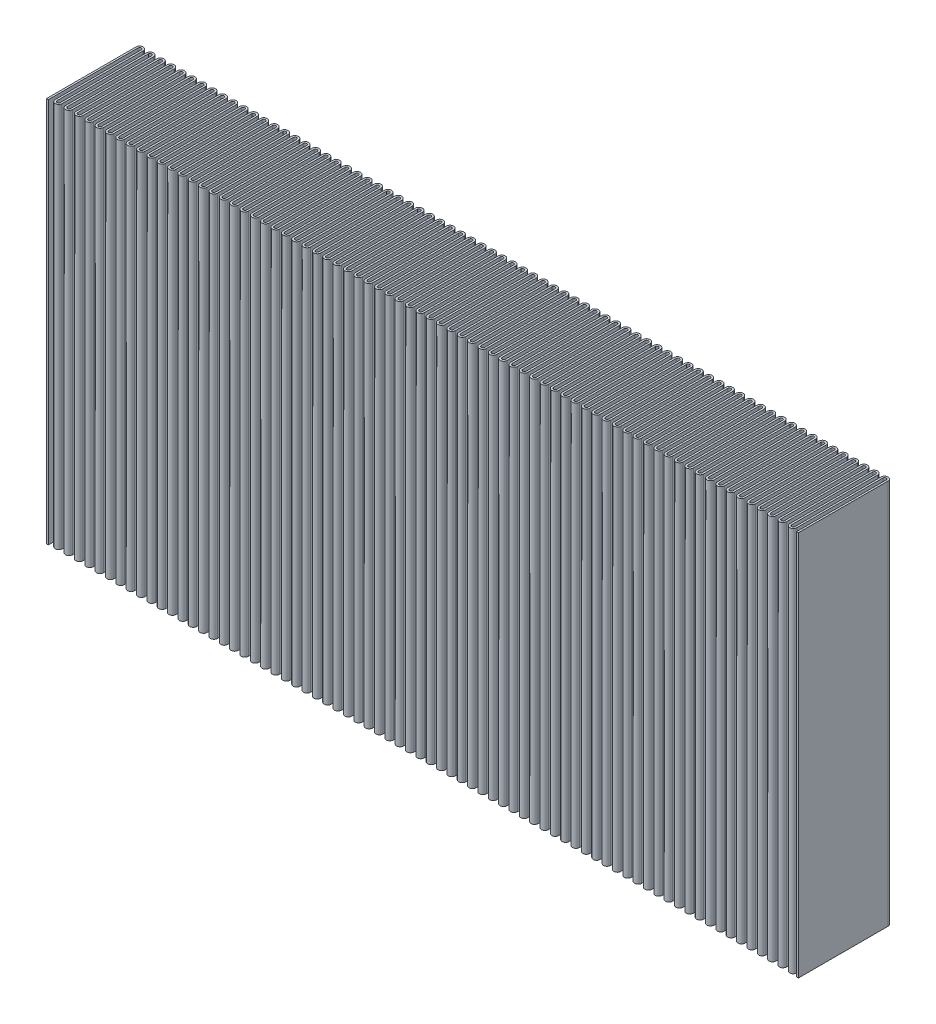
SolidWorks part; units mm, degrees
ref_plane "Front Plane" through (0, 0, 0) normal (0, 0, 1) x (1, 0, 0)
ref_plane "Top Plane" through (0, 0, 0) normal (0, 1, 0) x (1, 0, 0)
ref_plane "Right Plane" through (0, 0, 0) normal (1, 0, 0) x (0, 0, -1)
sketch "Sketch1" plane through (0, 0, 0) normal (0, 1, 0) x (1, 0, 0)
  line L8 (0, 0) -> (0, 9.9) construction
  line L9 (0, 9.9) -> (0.55, 9.9) construction
  line L10 (0.55, 9.9) -> (0.55, 0) construction
  line L11 (0.55, 0) -> (0, 0) construction
  line L12 (0.275, 9.9) -> (0.275, 9.78) construction
  line L13 (0.175, 9.525) -> (0.175, 0.375)
  line L14 (0.375, 9.525) -> (0.375, 0.375)
  line L18 (0, 9.9) -> (0, 9.7)
  line L19 (0.55, 0) -> (0.55, 0.2)
  line L20 (-0.175, 9.525) -> (-0.175, 0.375)
  line L21 (-0.375, 9.525) -> (-0.375, 0.375)
  line L22 (-0.175, 0.375) -> (-0.175, 0)
  line L23 (-0.175, 0) -> (-0.375, 0)
  line L24 (-0.375, 0) -> (-0.375, 0.375)
  line L25 (-0.375, 0) -> (79.575, 0) construction
  line L26 (0.925, 9.525) -> (0.925, 0.375)
  line L27 (0.725, 9.525) -> (0.725, 0.375)
  line L28 (1.1, 9.9) -> (1.1, 9.7) construction
  line L29 (1.275, 9.525) -> (1.275, 0.375)
  line L30 (1.475, 9.525) -> (1.475, 0.375)
  line L31 (2.025, 9.525) -> (2.025, 0.375)
  line L32 (1.825, 9.525) -> (1.825, 0.375)
  line L33 (2.375, 9.525) -> (2.375, 0.375)
  line L34 (2.575, 9.525) -> (2.575, 0.375)
  line L35 (3.125, 9.525) -> (3.125, 0.375)
  line L36 (2.925, 9.525) -> (2.925, 0.375)
  line L37 (3.475, 9.525) -> (3.475, 0.375)
  line L38 (3.675, 9.525) -> (3.675, 0.375)
  line L39 (4.225, 9.525) -> (4.225, 0.375)
  line L40 (4.025, 9.525) -> (4.025, 0.375)
  line L41 (4.575, 9.525) -> (4.575, 0.375)
  line L42 (4.775, 9.525) -> (4.775, 0.375)
  line L43 (5.325, 9.525) -> (5.325, 0.375)
  line L44 (5.125, 9.525) -> (5.125, 0.375)
  line L45 (5.675, 9.525) -> (5.675, 0.375)
  line L46 (5.875, 9.525) -> (5.875, 0.375)
  line L47 (6.425, 9.525) -> (6.425, 0.375)
  line L48 (6.225, 9.525) -> (6.225, 0.375)
  line L49 (6.775, 9.525) -> (6.775, 0.375)
  line L50 (6.975, 9.525) -> (6.975, 0.375)
  line L51 (7.525, 9.525) -> (7.525, 0.375)
  line L52 (7.325, 9.525) -> (7.325, 0.375)
  line L53 (7.875, 9.525) -> (7.875, 0.375)
  line L54 (8.075, 9.525) -> (8.075, 0.375)
  line L55 (8.625, 9.525) -> (8.625, 0.375)
  line L56 (8.425, 9.525) -> (8.425, 0.375)
  line L57 (8.975, 9.525) -> (8.975, 0.375)
  line L58 (9.175, 9.525) -> (9.175, 0.375)
  line L59 (9.725, 9.525) -> (9.725, 0.375)
  line L60 (9.525, 9.525) -> (9.525, 0.375)
  line L61 (10.075, 9.525) -> (10.075, 0.375)
  line L62 (10.275, 9.525) -> (10.275, 0.375)
  line L63 (10.825, 9.525) -> (10.825, 0.375)
  line L64 (10.625, 9.525) -> (10.625, 0.375)
  line L65 (11.175, 9.525) -> (11.175, 0.375)
  line L66 (11.375, 9.525) -> (11.375, 0.375)
  line L67 (11.925, 9.525) -> (11.925, 0.375)
  line L68 (11.725, 9.525) -> (11.725, 0.375)
  line L69 (12.275, 9.525) -> (12.275, 0.375)
  line L70 (12.475, 9.525) -> (12.475, 0.375)
  line L71 (13.025, 9.525) -> (13.025, 0.375)
  line L72 (12.825, 9.525) -> (12.825, 0.375)
  line L73 (13.375, 9.525) -> (13.375, 0.375)
  line L74 (13.575, 9.525) -> (13.575, 0.375)
  line L75 (14.125, 9.525) -> (14.125, 0.375)
  line L76 (13.925, 9.525) -> (13.925, 0.375)
  line L77 (14.475, 9.525) -> (14.475, 0.375)
  line L78 (14.675, 9.525) -> (14.675, 0.375)
  line L79 (15.225, 9.525) -> (15.225, 0.375)
  line L80 (15.025, 9.525) -> (15.025, 0.375)
  line L81 (15.575, 9.525) -> (15.575, 0.375)
  line L82 (15.775, 9.525) -> (15.775, 0.375)
  line L83 (16.325, 9.525) -> (16.325, 0.375)
  line L84 (16.125, 9.525) -> (16.125, 0.375)
  line L85 (16.675, 9.525) -> (16.675, 0.375)
  line L86 (16.875, 9.525) -> (16.875, 0.375)
  line L87 (17.425, 9.525) -> (17.425, 0.375)
  line L88 (17.225, 9.525) -> (17.225, 0.375)
  line L89 (17.775, 9.525) -> (17.775, 0.375)
  line L90 (17.975, 9.525) -> (17.975, 0.375)
  line L91 (18.525, 9.525) -> (18.525, 0.375)
  line L92 (18.325, 9.525) -> (18.325, 0.375)
  line L93 (18.875, 9.525) -> (18.875, 0.375)
  line L94 (19.075, 9.525) -> (19.075, 0.375)
  line L95 (19.625, 9.525) -> (19.625, 0.375)
  line L96 (19.425, 9.525) -> (19.425, 0.375)
  line L97 (19.975, 9.525) -> (19.975, 0.375)
  line L98 (20.175, 9.525) -> (20.175, 0.375)
  line L99 (20.725, 9.525) -> (20.725, 0.375)
  line L100 (20.525, 9.525) -> (20.525, 0.375)
  line L101 (21.075, 9.525) -> (21.075, 0.375)
  line L102 (21.275, 9.525) -> (21.275, 0.375)
  line L103 (21.825, 9.525) -> (21.825, 0.375)
  line L104 (21.625, 9.525) -> (21.625, 0.375)
  line L105 (22.175, 9.525) -> (22.175, 0.375)
  line L106 (22.375, 9.525) -> (22.375, 0.375)
  line L107 (22.925, 9.525) -> (22.925, 0.375)
  line L108 (22.725, 9.525) -> (22.725, 0.375)
  line L109 (23.275, 9.525) -> (23.275, 0.375)
  line L110 (23.475, 9.525) -> (23.475, 0.375)
  line L111 (24.025, 9.525) -> (24.025, 0.375)
  line L112 (23.825, 9.525) -> (23.825, 0.375)
  line L113 (24.375, 9.525) -> (24.375, 0.375)
  line L114 (24.575, 9.525) -> (24.575, 0.375)
  line L115 (25.125, 9.525) -> (25.125, 0.375)
  line L116 (24.925, 9.525) -> (24.925, 0.375)
  line L117 (25.475, 9.525) -> (25.475, 0.375)
  line L118 (25.675, 9.525) -> (25.675, 0.375)
  line L119 (26.225, 9.525) -> (26.225, 0.375)
  line L120 (26.025, 9.525) -> (26.025, 0.375)
  line L121 (26.575, 9.525) -> (26.575, 0.375)
  line L122 (26.775, 9.525) -> (26.775, 0.375)
  line L123 (27.325, 9.525) -> (27.325, 0.375)
  line L124 (27.125, 9.525) -> (27.125, 0.375)
  line L125 (27.675, 9.525) -> (27.675, 0.375)
  line L126 (27.875, 9.525) -> (27.875, 0.375)
  line L127 (28.425, 9.525) -> (28.425, 0.375)
  line L128 (28.225, 9.525) -> (28.225, 0.375)
  line L129 (28.775, 9.525) -> (28.775, 0.375)
  line L130 (28.975, 9.525) -> (28.975, 0.375)
  line L131 (29.525, 9.525) -> (29.525, 0.375)
  line L132 (29.325, 9.525) -> (29.325, 0.375)
  line L133 (29.875, 9.525) -> (29.875, 0.375)
  line L134 (30.075, 9.525) -> (30.075, 0.375)
  line L135 (30.625, 9.525) -> (30.625, 0.375)
  line L136 (30.425, 9.525) -> (30.425, 0.375)
  line L137 (30.975, 9.525) -> (30.975, 0.375)
  line L138 (31.175, 9.525) -> (31.175, 0.375)
  line L139 (31.725, 9.525) -> (31.725, 0.375)
  line L140 (31.525, 9.525) -> (31.525, 0.375)
  line L141 (32.075, 9.525) -> (32.075, 0.375)
  line L142 (32.275, 9.525) -> (32.275, 0.375)
  line L143 (32.825, 9.525) -> (32.825, 0.375)
  line L144 (32.625, 9.525) -> (32.625, 0.375)
  line L145 (33.175, 9.525) -> (33.175, 0.375)
  line L146 (33.375, 9.525) -> (33.375, 0.375)
  line L147 (33.925, 9.525) -> (33.925, 0.375)
  line L148 (33.725, 9.525) -> (33.725, 0.375)
  line L149 (34.275, 9.525) -> (34.275, 0.375)
  line L150 (34.475, 9.525) -> (34.475, 0.375)
  line L151 (35.025, 9.525) -> (35.025, 0.375)
  line L152 (34.825, 9.525) -> (34.825, 0.375)
  line L153 (35.375, 9.525) -> (35.375, 0.375)
  line L154 (35.575, 9.525) -> (35.575, 0.375)
  line L155 (36.125, 9.525) -> (36.125, 0.375)
  line L156 (35.925, 9.525) -> (35.925, 0.375)
  line L157 (79.375, 9.525) -> (79.375, 0)
  line L158 (79.375, 0) -> (79.575, 0)
  line L159 (79.575, 0) -> (79.575, 9.525)
  line L160 (36.475, 9.525) -> (36.475, 0.375)
  line L161 (36.675, 9.525) -> (36.675, 0.375)
  line L162 (37.225, 9.525) -> (37.225, 0.375)
  line L163 (37.025, 9.525) -> (37.025, 0.375)
  line L164 (37.575, 9.525) -> (37.575, 0.375)
  line L165 (37.775, 9.525) -> (37.775, 0.375)
  line L166 (38.325, 9.525) -> (38.325, 0.375)
  line L167 (38.125, 9.525) -> (38.125, 0.375)
  line L168 (38.675, 9.525) -> (38.675, 0.375)
  line L169 (38.875, 9.525) -> (38.875, 0.375)
  line L170 (39.425, 9.525) -> (39.425, 0.375)
  line L171 (39.225, 9.525) -> (39.225, 0.375)
  line L172 (39.775, 9.525) -> (39.775, 0.375)
  line L173 (39.975, 9.525) -> (39.975, 0.375)
  line L174 (40.525, 9.525) -> (40.525, 0.375)
  line L175 (40.325, 9.525) -> (40.325, 0.375)
  line L176 (40.875, 9.525) -> (40.875, 0.375)
  line L177 (41.075, 9.525) -> (41.075, 0.375)
  line L178 (41.625, 9.525) -> (41.625, 0.375)
  line L179 (41.425, 9.525) -> (41.425, 0.375)
  line L180 (41.975, 9.525) -> (41.975, 0.375)
  line L181 (42.175, 9.525) -> (42.175, 0.375)
  line L182 (42.725, 9.525) -> (42.725, 0.375)
  line L183 (42.525, 9.525) -> (42.525, 0.375)
  line L184 (43.075, 9.525) -> (43.075, 0.375)
  line L185 (43.275, 9.525) -> (43.275, 0.375)
  line L186 (43.825, 9.525) -> (43.825, 0.375)
  line L187 (43.625, 9.525) -> (43.625, 0.375)
  line L188 (44.175, 9.525) -> (44.175, 0.375)
  line L189 (44.375, 9.525) -> (44.375, 0.375)
  line L190 (44.925, 9.525) -> (44.925, 0.375)
  line L191 (44.725, 9.525) -> (44.725, 0.375)
  line L192 (45.275, 9.525) -> (45.275, 0.375)
  line L193 (45.475, 9.525) -> (45.475, 0.375)
  line L194 (46.025, 9.525) -> (46.025, 0.375)
  line L195 (45.825, 9.525) -> (45.825, 0.375)
  line L196 (46.375, 9.525) -> (46.375, 0.375)
  line L197 (46.575, 9.525) -> (46.575, 0.375)
  line L198 (47.125, 9.525) -> (47.125, 0.375)
  line L199 (46.925, 9.525) -> (46.925, 0.375)
  line L200 (47.475, 9.525) -> (47.475, 0.375)
  line L201 (47.675, 9.525) -> (47.675, 0.375)
  line L202 (48.225, 9.525) -> (48.225, 0.375)
  line L203 (48.025, 9.525) -> (48.025, 0.375)
  line L204 (48.575, 9.525) -> (48.575, 0.375)
  line L205 (48.775, 9.525) -> (48.775, 0.375)
  line L206 (49.325, 9.525) -> (49.325, 0.375)
  line L207 (49.125, 9.525) -> (49.125, 0.375)
  line L208 (49.675, 9.525) -> (49.675, 0.375)
  line L209 (49.875, 9.525) -> (49.875, 0.375)
  line L210 (50.425, 9.525) -> (50.425, 0.375)
  line L211 (50.225, 9.525) -> (50.225, 0.375)
  line L212 (50.775, 9.525) -> (50.775, 0.375)
  line L213 (50.975, 9.525) -> (50.975, 0.375)
  line L214 (51.525, 9.525) -> (51.525, 0.375)
  line L215 (51.325, 9.525) -> (51.325, 0.375)
  line L216 (51.875, 9.525) -> (51.875, 0.375)
  line L217 (52.075, 9.525) -> (52.075, 0.375)
  line L218 (52.625, 9.525) -> (52.625, 0.375)
  line L219 (52.425, 9.525) -> (52.425, 0.375)
  line L220 (52.975, 9.525) -> (52.975, 0.375)
  line L221 (53.175, 9.525) -> (53.175, 0.375)
  line L222 (53.725, 9.525) -> (53.725, 0.375)
  line L223 (53.525, 9.525) -> (53.525, 0.375)
  line L224 (54.075, 9.525) -> (54.075, 0.375)
  line L225 (54.275, 9.525) -> (54.275, 0.375)
  line L226 (54.825, 9.525) -> (54.825, 0.375)
  line L227 (54.625, 9.525) -> (54.625, 0.375)
  line L228 (55.175, 9.525) -> (55.175, 0.375)
  line L229 (55.375, 9.525) -> (55.375, 0.375)
  line L230 (55.925, 9.525) -> (55.925, 0.375)
  line L231 (55.725, 9.525) -> (55.725, 0.375)
  line L232 (56.275, 9.525) -> (56.275, 0.375)
  line L233 (56.475, 9.525) -> (56.475, 0.375)
  line L234 (57.025, 9.525) -> (57.025, 0.375)
  line L235 (56.825, 9.525) -> (56.825, 0.375)
  line L236 (57.375, 9.525) -> (57.375, 0.375)
  line L237 (57.575, 9.525) -> (57.575, 0.375)
  line L238 (58.125, 9.525) -> (58.125, 0.375)
  line L239 (57.925, 9.525) -> (57.925, 0.375)
  line L240 (58.475, 9.525) -> (58.475, 0.375)
  line L241 (58.675, 9.525) -> (58.675, 0.375)
  line L242 (59.225, 9.525) -> (59.225, 0.375)
  line L243 (59.025, 9.525) -> (59.025, 0.375)
  line L244 (59.575, 9.525) -> (59.575, 0.375)
  line L245 (59.775, 9.525) -> (59.775, 0.375)
  line L246 (60.325, 9.525) -> (60.325, 0.375)
  line L247 (60.125, 9.525) -> (60.125, 0.375)
  line L248 (60.675, 9.525) -> (60.675, 0.375)
  line L249 (60.875, 9.525) -> (60.875, 0.375)
  line L250 (61.425, 9.525) -> (61.425, 0.375)
  line L251 (61.225, 9.525) -> (61.225, 0.375)
  line L252 (61.775, 9.525) -> (61.775, 0.375)
  line L253 (61.975, 9.525) -> (61.975, 0.375)
  line L254 (62.525, 9.525) -> (62.525, 0.375)
  line L255 (62.325, 9.525) -> (62.325, 0.375)
  line L256 (62.875, 9.525) -> (62.875, 0.375)
  line L257 (63.075, 9.525) -> (63.075, 0.375)
  line L258 (63.625, 9.525) -> (63.625, 0.375)
  line L259 (63.425, 9.525) -> (63.425, 0.375)
  line L260 (63.975, 9.525) -> (63.975, 0.375)
  line L261 (64.175, 9.525) -> (64.175, 0.375)
  line L262 (64.725, 9.525) -> (64.725, 0.375)
  line L263 (64.525, 9.525) -> (64.525, 0.375)
  line L264 (65.075, 9.525) -> (65.075, 0.375)
  line L265 (65.275, 9.525) -> (65.275, 0.375)
  line L266 (65.825, 9.525) -> (65.825, 0.375)
  line L267 (65.625, 9.525) -> (65.625, 0.375)
  line L268 (66.175, 9.525) -> (66.175, 0.375)
  line L269 (66.375, 9.525) -> (66.375, 0.375)
  line L270 (66.925, 9.525) -> (66.925, 0.375)
  line L271 (66.725, 9.525) -> (66.725, 0.375)
  line L272 (67.275, 9.525) -> (67.275, 0.375)
  line L273 (67.475, 9.525) -> (67.475, 0.375)
  line L274 (68.025, 9.525) -> (68.025, 0.375)
  line L275 (67.825, 9.525) -> (67.825, 0.375)
  line L276 (68.375, 9.525) -> (68.375, 0.375)
  line L277 (68.575, 9.525) -> (68.575, 0.375)
  line L278 (69.125, 9.525) -> (69.125, 0.375)
  line L279 (68.925, 9.525) -> (68.925, 0.375)
  line L280 (69.475, 9.525) -> (69.475, 0.375)
  line L281 (69.675, 9.525) -> (69.675, 0.375)
  line L282 (70.225, 9.525) -> (70.225, 0.375)
  line L283 (70.025, 9.525) -> (70.025, 0.375)
  line L284 (70.575, 9.525) -> (70.575, 0.375)
  line L285 (70.775, 9.525) -> (70.775, 0.375)
  line L286 (71.325, 9.525) -> (71.325, 0.375)
  line L287 (71.125, 9.525) -> (71.125, 0.375)
  line L288 (71.675, 9.525) -> (71.675, 0.375)
  line L289 (71.875, 9.525) -> (71.875, 0.375)
  line L290 (72.425, 9.525) -> (72.425, 0.375)
  line L291 (72.225, 9.525) -> (72.225, 0.375)
  line L292 (72.775, 9.525) -> (72.775, 0.375)
  line L293 (72.975, 9.525) -> (72.975, 0.375)
  line L294 (73.525, 9.525) -> (73.525, 0.375)
  line L295 (73.325, 9.525) -> (73.325, 0.375)
  line L296 (73.875, 9.525) -> (73.875, 0.375)
  line L297 (74.075, 9.525) -> (74.075, 0.375)
  line L298 (74.625, 9.525) -> (74.625, 0.375)
  line L299 (74.425, 9.525) -> (74.425, 0.375)
  line L300 (74.975, 9.525) -> (74.975, 0.375)
  line L301 (75.175, 9.525) -> (75.175, 0.375)
  line L302 (75.725, 9.525) -> (75.725, 0.375)
  line L303 (75.525, 9.525) -> (75.525, 0.375)
  line L304 (76.075, 9.525) -> (76.075, 0.375)
  line L305 (76.275, 9.525) -> (76.275, 0.375)
  line L306 (76.825, 9.525) -> (76.825, 0.375)
  line L307 (76.625, 9.525) -> (76.625, 0.375)
  line L308 (77.175, 9.525) -> (77.175, 0.375)
  line L309 (77.375, 9.525) -> (77.375, 0.375)
  line L310 (77.925, 9.525) -> (77.925, 0.375)
  line L311 (77.725, 9.525) -> (77.725, 0.375)
  line L312 (78.275, 9.525) -> (78.275, 0.375)
  line L313 (78.475, 9.525) -> (78.475, 0.375)
  line L314 (79.025, 9.525) -> (79.025, 0.375)
  line L315 (78.825, 9.525) -> (78.825, 0.375)
  line L316 (0.175, 9.525) -> (1.275, 9.525) construction
  arc A3 (0.375, 9.525) -> (0, 9.9) centre (0, 9.525) ccw
  arc A4 (0.175, 9.525) -> (0, 9.7) centre (0, 9.525) ccw
  arc A5 (0.175, 0.375) -> (0.925, 0.375) centre (0.55, 0.375) ccw
  arc A6 (0.375, 0.375) -> (0.725, 0.375) centre (0.55, 0.375) ccw
  arc A7 (0.925, 9.525) -> (1.1, 9.7) centre (1.1, 9.525) cw
  arc A8 (0.725, 9.525) -> (1.1, 9.9) centre (1.1, 9.525) cw
  arc A9 (0, 9.7) -> (-0.175, 9.525) centre (0, 9.525) ccw
  arc A10 (0, 9.9) -> (-0.375, 9.525) centre (0, 9.525) ccw
  arc A11 (1.275, 9.525) -> (1.1, 9.7) centre (1.1, 9.525) ccw
  arc A12 (1.475, 9.525) -> (1.1, 9.9) centre (1.1, 9.525) ccw
  arc A13 (1.475, 0.375) -> (1.825, 0.375) centre (1.65, 0.375) ccw
  arc A14 (1.275, 0.375) -> (2.025, 0.375) centre (1.65, 0.375) ccw
  arc A15 (1.825, 9.525) -> (2.2, 9.9) centre (2.2, 9.525) cw
  arc A16 (2.025, 9.525) -> (2.2, 9.7) centre (2.2, 9.525) cw
  arc A17 (2.375, 9.525) -> (2.2, 9.7) centre (2.2, 9.525) ccw
  arc A18 (2.575, 9.525) -> (2.2, 9.9) centre (2.2, 9.525) ccw
  arc A19 (2.575, 0.375) -> (2.925, 0.375) centre (2.75, 0.375) ccw
  arc A20 (2.375, 0.375) -> (3.125, 0.375) centre (2.75, 0.375) ccw
  arc A21 (2.925, 9.525) -> (3.3, 9.9) centre (3.3, 9.525) cw
  arc A22 (3.125, 9.525) -> (3.3, 9.7) centre (3.3, 9.525) cw
  arc A23 (3.475, 9.525) -> (3.3, 9.7) centre (3.3, 9.525) ccw
  arc A24 (3.675, 9.525) -> (3.3, 9.9) centre (3.3, 9.525) ccw
  arc A25 (3.675, 0.375) -> (4.025, 0.375) centre (3.85, 0.375) ccw
  arc A26 (3.475, 0.375) -> (4.225, 0.375) centre (3.85, 0.375) ccw
  arc A27 (4.025, 9.525) -> (4.4, 9.9) centre (4.4, 9.525) cw
  arc A28 (4.225, 9.525) -> (4.4, 9.7) centre (4.4, 9.525) cw
  arc A29 (4.575, 9.525) -> (4.4, 9.7) centre (4.4, 9.525) ccw
  arc A30 (4.775, 9.525) -> (4.4, 9.9) centre (4.4, 9.525) ccw
  arc A31 (4.775, 0.375) -> (5.125, 0.375) centre (4.95, 0.375) ccw
  arc A32 (4.575, 0.375) -> (5.325, 0.375) centre (4.95, 0.375) ccw
  arc A33 (5.125, 9.525) -> (5.5, 9.9) centre (5.5, 9.525) cw
  arc A34 (5.325, 9.525) -> (5.5, 9.7) centre (5.5, 9.525) cw
  arc A35 (5.675, 9.525) -> (5.5, 9.7) centre (5.5, 9.525) ccw
  arc A36 (5.875, 9.525) -> (5.5, 9.9) centre (5.5, 9.525) ccw
  arc A37 (5.875, 0.375) -> (6.225, 0.375) centre (6.05, 0.375) ccw
  arc A38 (5.675, 0.375) -> (6.425, 0.375) centre (6.05, 0.375) ccw
  arc A39 (6.225, 9.525) -> (6.6, 9.9) centre (6.6, 9.525) cw
  arc A40 (6.425, 9.525) -> (6.6, 9.7) centre (6.6, 9.525) cw
  arc A41 (6.775, 9.525) -> (6.6, 9.7) centre (6.6, 9.525) ccw
  arc A42 (6.975, 9.525) -> (6.6, 9.9) centre (6.6, 9.525) ccw
  arc A43 (6.975, 0.375) -> (7.325, 0.375) centre (7.15, 0.375) ccw
  arc A44 (6.775, 0.375) -> (7.525, 0.375) centre (7.15, 0.375) ccw
  arc A45 (7.325, 9.525) -> (7.7, 9.9) centre (7.7, 9.525) cw
  arc A46 (7.525, 9.525) -> (7.7, 9.7) centre (7.7, 9.525) cw
  arc A47 (7.875, 9.525) -> (7.7, 9.7) centre (7.7, 9.525) ccw
  arc A48 (8.075, 9.525) -> (7.7, 9.9) centre (7.7, 9.525) ccw
  arc A49 (8.075, 0.375) -> (8.425, 0.375) centre (8.25, 0.375) ccw
  arc A50 (7.875, 0.375) -> (8.625, 0.375) centre (8.25, 0.375) ccw
  arc A51 (8.425, 9.525) -> (8.8, 9.9) centre (8.8, 9.525) cw
  arc A52 (8.625, 9.525) -> (8.8, 9.7) centre (8.8, 9.525) cw
  arc A53 (8.975, 9.525) -> (8.8, 9.7) centre (8.8, 9.525) ccw
  arc A54 (9.175, 9.525) -> (8.8, 9.9) centre (8.8, 9.525) ccw
  arc A55 (9.175, 0.375) -> (9.525, 0.375) centre (9.35, 0.375) ccw
  arc A56 (8.975, 0.375) -> (9.725, 0.375) centre (9.35, 0.375) ccw
  arc A57 (9.525, 9.525) -> (9.9, 9.9) centre (9.9, 9.525) cw
  arc A58 (9.725, 9.525) -> (9.9, 9.7) centre (9.9, 9.525) cw
  arc A59 (10.075, 9.525) -> (9.9, 9.7) centre (9.9, 9.525) ccw
  arc A60 (10.275, 9.525) -> (9.9, 9.9) centre (9.9, 9.525) ccw
  arc A61 (10.275, 0.375) -> (10.625, 0.375) centre (10.45, 0.375) ccw
  arc A62 (10.075, 0.375) -> (10.825, 0.375) centre (10.45, 0.375) ccw
  arc A63 (10.625, 9.525) -> (11, 9.9) centre (11, 9.525) cw
  arc A64 (10.825, 9.525) -> (11, 9.7) centre (11, 9.525) cw
  arc A65 (11.175, 9.525) -> (11, 9.7) centre (11, 9.525) ccw
  arc A66 (11.375, 9.525) -> (11, 9.9) centre (11, 9.525) ccw
  arc A67 (11.375, 0.375) -> (11.725, 0.375) centre (11.55, 0.375) ccw
  arc A68 (11.175, 0.375) -> (11.925, 0.375) centre (11.55, 0.375) ccw
  arc A69 (11.725, 9.525) -> (12.1, 9.9) centre (12.1, 9.525) cw
  arc A70 (11.925, 9.525) -> (12.1, 9.7) centre (12.1, 9.525) cw
  arc A71 (12.275, 9.525) -> (12.1, 9.7) centre (12.1, 9.525) ccw
  arc A72 (12.475, 9.525) -> (12.1, 9.9) centre (12.1, 9.525) ccw
  arc A73 (12.475, 0.375) -> (12.825, 0.375) centre (12.65, 0.375) ccw
  arc A74 (12.275, 0.375) -> (13.025, 0.375) centre (12.65, 0.375) ccw
  arc A75 (12.825, 9.525) -> (13.2, 9.9) centre (13.2, 9.525) cw
  arc A76 (13.025, 9.525) -> (13.2, 9.7) centre (13.2, 9.525) cw
  arc A77 (13.375, 9.525) -> (13.2, 9.7) centre (13.2, 9.525) ccw
  arc A78 (13.575, 9.525) -> (13.2, 9.9) centre (13.2, 9.525) ccw
  arc A79 (13.575, 0.375) -> (13.925, 0.375) centre (13.75, 0.375) ccw
  arc A80 (13.375, 0.375) -> (14.125, 0.375) centre (13.75, 0.375) ccw
  arc A81 (13.925, 9.525) -> (14.3, 9.9) centre (14.3, 9.525) cw
  arc A82 (14.125, 9.525) -> (14.3, 9.7) centre (14.3, 9.525) cw
  arc A83 (14.475, 9.525) -> (14.3, 9.7) centre (14.3, 9.525) ccw
  arc A84 (14.675, 9.525) -> (14.3, 9.9) centre (14.3, 9.525) ccw
  arc A85 (14.675, 0.375) -> (15.025, 0.375) centre (14.85, 0.375) ccw
  arc A86 (14.475, 0.375) -> (15.225, 0.375) centre (14.85, 0.375) ccw
  arc A87 (15.025, 9.525) -> (15.4, 9.9) centre (15.4, 9.525) cw
  arc A88 (15.225, 9.525) -> (15.4, 9.7) centre (15.4, 9.525) cw
  arc A89 (15.575, 9.525) -> (15.4, 9.7) centre (15.4, 9.525) ccw
  arc A90 (15.775, 9.525) -> (15.4, 9.9) centre (15.4, 9.525) ccw
  arc A91 (15.775, 0.375) -> (16.125, 0.375) centre (15.95, 0.375) ccw
  arc A92 (15.575, 0.375) -> (16.325, 0.375) centre (15.95, 0.375) ccw
  arc A93 (16.125, 9.525) -> (16.5, 9.9) centre (16.5, 9.525) cw
  arc A94 (16.325, 9.525) -> (16.5, 9.7) centre (16.5, 9.525) cw
  arc A95 (16.675, 9.525) -> (16.5, 9.7) centre (16.5, 9.525) ccw
  arc A96 (16.875, 9.525) -> (16.5, 9.9) centre (16.5, 9.525) ccw
  arc A97 (16.875, 0.375) -> (17.225, 0.375) centre (17.05, 0.375) ccw
  arc A98 (16.675, 0.375) -> (17.425, 0.375) centre (17.05, 0.375) ccw
  arc A99 (17.225, 9.525) -> (17.6, 9.9) centre (17.6, 9.525) cw
  arc A100 (17.425, 9.525) -> (17.6, 9.7) centre (17.6, 9.525) cw
  arc A101 (17.775, 9.525) -> (17.6, 9.7) centre (17.6, 9.525) ccw
  arc A102 (17.975, 9.525) -> (17.6, 9.9) centre (17.6, 9.525) ccw
  arc A103 (17.975, 0.375) -> (18.325, 0.375) centre (18.15, 0.375) ccw
  arc A104 (17.775, 0.375) -> (18.525, 0.375) centre (18.15, 0.375) ccw
  arc A105 (18.325, 9.525) -> (18.7, 9.9) centre (18.7, 9.525) cw
  arc A106 (18.525, 9.525) -> (18.7, 9.7) centre (18.7, 9.525) cw
  arc A107 (18.875, 9.525) -> (18.7, 9.7) centre (18.7, 9.525) ccw
  arc A108 (19.075, 9.525) -> (18.7, 9.9) centre (18.7, 9.525) ccw
  arc A109 (19.075, 0.375) -> (19.425, 0.375) centre (19.25, 0.375) ccw
  arc A110 (18.875, 0.375) -> (19.625, 0.375) centre (19.25, 0.375) ccw
  arc A111 (19.425, 9.525) -> (19.8, 9.9) centre (19.8, 9.525) cw
  arc A112 (19.625, 9.525) -> (19.8, 9.7) centre (19.8, 9.525) cw
  arc A113 (19.975, 9.525) -> (19.8, 9.7) centre (19.8, 9.525) ccw
  arc A114 (20.175, 9.525) -> (19.8, 9.9) centre (19.8, 9.525) ccw
  arc A115 (20.175, 0.375) -> (20.525, 0.375) centre (20.35, 0.375) ccw
  arc A116 (19.975, 0.375) -> (20.725, 0.375) centre (20.35, 0.375) ccw
  arc A117 (20.525, 9.525) -> (20.9, 9.9) centre (20.9, 9.525) cw
  arc A118 (20.725, 9.525) -> (20.9, 9.7) centre (20.9, 9.525) cw
  arc A119 (21.075, 9.525) -> (20.9, 9.7) centre (20.9, 9.525) ccw
  arc A120 (21.275, 9.525) -> (20.9, 9.9) centre (20.9, 9.525) ccw
  arc A121 (21.275, 0.375) -> (21.625, 0.375) centre (21.45, 0.375) ccw
  arc A122 (21.075, 0.375) -> (21.825, 0.375) centre (21.45, 0.375) ccw
  arc A123 (21.625, 9.525) -> (22, 9.9) centre (22, 9.525) cw
  arc A124 (21.825, 9.525) -> (22, 9.7) centre (22, 9.525) cw
  arc A125 (22.175, 9.525) -> (22, 9.7) centre (22, 9.525) ccw
  arc A126 (22.375, 9.525) -> (22, 9.9) centre (22, 9.525) ccw
  arc A127 (22.375, 0.375) -> (22.725, 0.375) centre (22.55, 0.375) ccw
  arc A128 (22.175, 0.375) -> (22.925, 0.375) centre (22.55, 0.375) ccw
  arc A129 (22.725, 9.525) -> (23.1, 9.9) centre (23.1, 9.525) cw
  arc A130 (22.925, 9.525) -> (23.1, 9.7) centre (23.1, 9.525) cw
  arc A131 (23.275, 9.525) -> (23.1, 9.7) centre (23.1, 9.525) ccw
  arc A132 (23.475, 9.525) -> (23.1, 9.9) centre (23.1, 9.525) ccw
  arc A133 (23.475, 0.375) -> (23.825, 0.375) centre (23.65, 0.375) ccw
  arc A134 (23.275, 0.375) -> (24.025, 0.375) centre (23.65, 0.375) ccw
  arc A135 (23.825, 9.525) -> (24.2, 9.9) centre (24.2, 9.525) cw
  arc A136 (24.025, 9.525) -> (24.2, 9.7) centre (24.2, 9.525) cw
  arc A137 (24.375, 9.525) -> (24.2, 9.7) centre (24.2, 9.525) ccw
  arc A138 (24.575, 9.525) -> (24.2, 9.9) centre (24.2, 9.525) ccw
  arc A139 (24.575, 0.375) -> (24.925, 0.375) centre (24.75, 0.375) ccw
  arc A140 (24.375, 0.375) -> (25.125, 0.375) centre (24.75, 0.375) ccw
  arc A141 (24.925, 9.525) -> (25.3, 9.9) centre (25.3, 9.525) cw
  arc A142 (25.125, 9.525) -> (25.3, 9.7) centre (25.3, 9.525) cw
  arc A143 (25.475, 9.525) -> (25.3, 9.7) centre (25.3, 9.525) ccw
  arc A144 (25.675, 9.525) -> (25.3, 9.9) centre (25.3, 9.525) ccw
  arc A145 (25.675, 0.375) -> (26.025, 0.375) centre (25.85, 0.375) ccw
  arc A146 (25.475, 0.375) -> (26.225, 0.375) centre (25.85, 0.375) ccw
  arc A147 (26.025, 9.525) -> (26.4, 9.9) centre (26.4, 9.525) cw
  arc A148 (26.225, 9.525) -> (26.4, 9.7) centre (26.4, 9.525) cw
  arc A149 (26.575, 9.525) -> (26.4, 9.7) centre (26.4, 9.525) ccw
  arc A150 (26.775, 9.525) -> (26.4, 9.9) centre (26.4, 9.525) ccw
  arc A151 (26.775, 0.375) -> (27.125, 0.375) centre (26.95, 0.375) ccw
  arc A152 (26.575, 0.375) -> (27.325, 0.375) centre (26.95, 0.375) ccw
  arc A153 (27.125, 9.525) -> (27.5, 9.9) centre (27.5, 9.525) cw
  arc A154 (27.325, 9.525) -> (27.5, 9.7) centre (27.5, 9.525) cw
  arc A155 (27.675, 9.525) -> (27.5, 9.7) centre (27.5, 9.525) ccw
  arc A156 (27.875, 9.525) -> (27.5, 9.9) centre (27.5, 9.525) ccw
  arc A157 (27.875, 0.375) -> (28.225, 0.375) centre (28.05, 0.375) ccw
  arc A158 (27.675, 0.375) -> (28.425, 0.375) centre (28.05, 0.375) ccw
  arc A159 (28.225, 9.525) -> (28.6, 9.9) centre (28.6, 9.525) cw
  arc A160 (28.425, 9.525) -> (28.6, 9.7) centre (28.6, 9.525) cw
  arc A161 (28.775, 9.525) -> (28.6, 9.7) centre (28.6, 9.525) ccw
  arc A162 (28.975, 9.525) -> (28.6, 9.9) centre (28.6, 9.525) ccw
  arc A163 (28.975, 0.375) -> (29.325, 0.375) centre (29.15, 0.375) ccw
  arc A164 (28.775, 0.375) -> (29.525, 0.375) centre (29.15, 0.375) ccw
  arc A165 (29.325, 9.525) -> (29.7, 9.9) centre (29.7, 9.525) cw
  arc A166 (29.525, 9.525) -> (29.7, 9.7) centre (29.7, 9.525) cw
  arc A167 (29.875, 9.525) -> (29.7, 9.7) centre (29.7, 9.525) ccw
  arc A168 (30.075, 9.525) -> (29.7, 9.9) centre (29.7, 9.525) ccw
  arc A169 (30.075, 0.375) -> (30.425, 0.375) centre (30.25, 0.375) ccw
  arc A170 (29.875, 0.375) -> (30.625, 0.375) centre (30.25, 0.375) ccw
  arc A171 (30.425, 9.525) -> (30.8, 9.9) centre (30.8, 9.525) cw
  arc A172 (30.625, 9.525) -> (30.8, 9.7) centre (30.8, 9.525) cw
  arc A173 (30.975, 9.525) -> (30.8, 9.7) centre (30.8, 9.525) ccw
  arc A174 (31.175, 9.525) -> (30.8, 9.9) centre (30.8, 9.525) ccw
  arc A175 (31.175, 0.375) -> (31.525, 0.375) centre (31.35, 0.375) ccw
  arc A176 (30.975, 0.375) -> (31.725, 0.375) centre (31.35, 0.375) ccw
  arc A177 (31.525, 9.525) -> (31.9, 9.9) centre (31.9, 9.525) cw
  arc A178 (31.725, 9.525) -> (31.9, 9.7) centre (31.9, 9.525) cw
  arc A179 (32.075, 9.525) -> (31.9, 9.7) centre (31.9, 9.525) ccw
  arc A180 (32.275, 9.525) -> (31.9, 9.9) centre (31.9, 9.525) ccw
  arc A181 (32.275, 0.375) -> (32.625, 0.375) centre (32.45, 0.375) ccw
  arc A182 (32.075, 0.375) -> (32.825, 0.375) centre (32.45, 0.375) ccw
  arc A183 (32.625, 9.525) -> (33, 9.9) centre (33, 9.525) cw
  arc A184 (32.825, 9.525) -> (33, 9.7) centre (33, 9.525) cw
  arc A185 (33.175, 9.525) -> (33, 9.7) centre (33, 9.525) ccw
  arc A186 (33.375, 9.525) -> (33, 9.9) centre (33, 9.525) ccw
  arc A187 (33.375, 0.375) -> (33.725, 0.375) centre (33.55, 0.375) ccw
  arc A188 (33.175, 0.375) -> (33.925, 0.375) centre (33.55, 0.375) ccw
  arc A189 (33.725, 9.525) -> (34.1, 9.9) centre (34.1, 9.525) cw
  arc A190 (33.925, 9.525) -> (34.1, 9.7) centre (34.1, 9.525) cw
  arc A191 (34.275, 9.525) -> (34.1, 9.7) centre (34.1, 9.525) ccw
  arc A192 (34.475, 9.525) -> (34.1, 9.9) centre (34.1, 9.525) ccw
  arc A193 (34.475, 0.375) -> (34.825, 0.375) centre (34.65, 0.375) ccw
  arc A194 (34.275, 0.375) -> (35.025, 0.375) centre (34.65, 0.375) ccw
  arc A195 (34.825, 9.525) -> (35.2, 9.9) centre (35.2, 9.525) cw
  arc A196 (35.025, 9.525) -> (35.2, 9.7) centre (35.2, 9.525) cw
  arc A197 (35.375, 9.525) -> (35.2, 9.7) centre (35.2, 9.525) ccw
  arc A198 (35.575, 9.525) -> (35.2, 9.9) centre (35.2, 9.525) ccw
  arc A199 (35.575, 0.375) -> (35.925, 0.375) centre (35.75, 0.375) ccw
  arc A200 (35.375, 0.375) -> (36.125, 0.375) centre (35.75, 0.375) ccw
  arc A201 (35.925, 9.525) -> (36.3, 9.9) centre (36.3, 9.525) cw
  arc A202 (36.125, 9.525) -> (36.3, 9.7) centre (36.3, 9.525) cw
  arc A203 (79.2, 9.7) -> (79.375, 9.525) centre (79.2, 9.525) cw
  arc A204 (79.2, 9.9) -> (79.575, 9.525) centre (79.2, 9.525) cw
  arc A205 (36.475, 9.525) -> (36.3, 9.7) centre (36.3, 9.525) ccw
  arc A206 (36.675, 9.525) -> (36.3, 9.9) centre (36.3, 9.525) ccw
  arc A207 (36.675, 0.375) -> (37.025, 0.375) centre (36.85, 0.375) ccw
  arc A208 (36.475, 0.375) -> (37.225, 0.375) centre (36.85, 0.375) ccw
  arc A209 (37.025, 9.525) -> (37.4, 9.9) centre (37.4, 9.525) cw
  arc A210 (37.225, 9.525) -> (37.4, 9.7) centre (37.4, 9.525) cw
  arc A211 (37.575, 9.525) -> (37.4, 9.7) centre (37.4, 9.525) ccw
  arc A212 (37.775, 9.525) -> (37.4, 9.9) centre (37.4, 9.525) ccw
  arc A213 (37.775, 0.375) -> (38.125, 0.375) centre (37.95, 0.375) ccw
  arc A214 (37.575, 0.375) -> (38.325, 0.375) centre (37.95, 0.375) ccw
  arc A215 (38.125, 9.525) -> (38.5, 9.9) centre (38.5, 9.525) cw
  arc A216 (38.325, 9.525) -> (38.5, 9.7) centre (38.5, 9.525) cw
  arc A217 (38.675, 9.525) -> (38.5, 9.7) centre (38.5, 9.525) ccw
  arc A218 (38.875, 9.525) -> (38.5, 9.9) centre (38.5, 9.525) ccw
  arc A219 (38.875, 0.375) -> (39.225, 0.375) centre (39.05, 0.375) ccw
  arc A220 (38.675, 0.375) -> (39.425, 0.375) centre (39.05, 0.375) ccw
  arc A221 (39.225, 9.525) -> (39.6, 9.9) centre (39.6, 9.525) cw
  arc A222 (39.425, 9.525) -> (39.6, 9.7) centre (39.6, 9.525) cw
  arc A223 (39.775, 9.525) -> (39.6, 9.7) centre (39.6, 9.525) ccw
  arc A224 (39.975, 9.525) -> (39.6, 9.9) centre (39.6, 9.525) ccw
  arc A225 (39.975, 0.375) -> (40.325, 0.375) centre (40.15, 0.375) ccw
  arc A226 (39.775, 0.375) -> (40.525, 0.375) centre (40.15, 0.375) ccw
  arc A227 (40.325, 9.525) -> (40.7, 9.9) centre (40.7, 9.525) cw
  arc A228 (40.525, 9.525) -> (40.7, 9.7) centre (40.7, 9.525) cw
  arc A229 (40.875, 9.525) -> (40.7, 9.7) centre (40.7, 9.525) ccw
  arc A230 (41.075, 9.525) -> (40.7, 9.9) centre (40.7, 9.525) ccw
  arc A231 (41.075, 0.375) -> (41.425, 0.375) centre (41.25, 0.375) ccw
  arc A232 (40.875, 0.375) -> (41.625, 0.375) centre (41.25, 0.375) ccw
  arc A233 (41.425, 9.525) -> (41.8, 9.9) centre (41.8, 9.525) cw
  arc A234 (41.625, 9.525) -> (41.8, 9.7) centre (41.8, 9.525) cw
  arc A235 (41.975, 9.525) -> (41.8, 9.7) centre (41.8, 9.525) ccw
  arc A236 (42.175, 9.525) -> (41.8, 9.9) centre (41.8, 9.525) ccw
  arc A237 (42.175, 0.375) -> (42.525, 0.375) centre (42.35, 0.375) ccw
  arc A238 (41.975, 0.375) -> (42.725, 0.375) centre (42.35, 0.375) ccw
  arc A239 (42.525, 9.525) -> (42.9, 9.9) centre (42.9, 9.525) cw
  arc A240 (42.725, 9.525) -> (42.9, 9.7) centre (42.9, 9.525) cw
  arc A241 (43.075, 9.525) -> (42.9, 9.7) centre (42.9, 9.525) ccw
  arc A242 (43.275, 9.525) -> (42.9, 9.9) centre (42.9, 9.525) ccw
  arc A243 (43.275, 0.375) -> (43.625, 0.375) centre (43.45, 0.375) ccw
  arc A244 (43.075, 0.375) -> (43.825, 0.375) centre (43.45, 0.375) ccw
  arc A245 (43.625, 9.525) -> (44, 9.9) centre (44, 9.525) cw
  arc A246 (43.825, 9.525) -> (44, 9.7) centre (44, 9.525) cw
  arc A247 (44.175, 9.525) -> (44, 9.7) centre (44, 9.525) ccw
  arc A248 (44.375, 9.525) -> (44, 9.9) centre (44, 9.525) ccw
  arc A249 (44.375, 0.375) -> (44.725, 0.375) centre (44.55, 0.375) ccw
  arc A250 (44.175, 0.375) -> (44.925, 0.375) centre (44.55, 0.375) ccw
  arc A251 (44.725, 9.525) -> (45.1, 9.9) centre (45.1, 9.525) cw
  arc A252 (44.925, 9.525) -> (45.1, 9.7) centre (45.1, 9.525) cw
  arc A253 (45.275, 9.525) -> (45.1, 9.7) centre (45.1, 9.525) ccw
  arc A254 (45.475, 9.525) -> (45.1, 9.9) centre (45.1, 9.525) ccw
  arc A255 (45.475, 0.375) -> (45.825, 0.375) centre (45.65, 0.375) ccw
  arc A256 (45.275, 0.375) -> (46.025, 0.375) centre (45.65, 0.375) ccw
  arc A257 (45.825, 9.525) -> (46.2, 9.9) centre (46.2, 9.525) cw
  arc A258 (46.025, 9.525) -> (46.2, 9.7) centre (46.2, 9.525) cw
  arc A259 (46.375, 9.525) -> (46.2, 9.7) centre (46.2, 9.525) ccw
  arc A260 (46.575, 9.525) -> (46.2, 9.9) centre (46.2, 9.525) ccw
  arc A261 (46.575, 0.375) -> (46.925, 0.375) centre (46.75, 0.375) ccw
  arc A262 (46.375, 0.375) -> (47.125, 0.375) centre (46.75, 0.375) ccw
  arc A263 (46.925, 9.525) -> (47.3, 9.9) centre (47.3, 9.525) cw
  arc A264 (47.125, 9.525) -> (47.3, 9.7) centre (47.3, 9.525) cw
  arc A265 (47.475, 9.525) -> (47.3, 9.7) centre (47.3, 9.525) ccw
  arc A266 (47.675, 9.525) -> (47.3, 9.9) centre (47.3, 9.525) ccw
  arc A267 (47.675, 0.375) -> (48.025, 0.375) centre (47.85, 0.375) ccw
  arc A268 (47.475, 0.375) -> (48.225, 0.375) centre (47.85, 0.375) ccw
  arc A269 (48.025, 9.525) -> (48.4, 9.9) centre (48.4, 9.525) cw
  arc A270 (48.225, 9.525) -> (48.4, 9.7) centre (48.4, 9.525) cw
  arc A271 (48.575, 9.525) -> (48.4, 9.7) centre (48.4, 9.525) ccw
  arc A272 (48.775, 9.525) -> (48.4, 9.9) centre (48.4, 9.525) ccw
  arc A273 (48.775, 0.375) -> (49.125, 0.375) centre (48.95, 0.375) ccw
  arc A274 (48.575, 0.375) -> (49.325, 0.375) centre (48.95, 0.375) ccw
  arc A275 (49.125, 9.525) -> (49.5, 9.9) centre (49.5, 9.525) cw
  arc A276 (49.325, 9.525) -> (49.5, 9.7) centre (49.5, 9.525) cw
  arc A277 (49.675, 9.525) -> (49.5, 9.7) centre (49.5, 9.525) ccw
  arc A278 (49.875, 9.525) -> (49.5, 9.9) centre (49.5, 9.525) ccw
  arc A279 (49.875, 0.375) -> (50.225, 0.375) centre (50.05, 0.375) ccw
  arc A280 (49.675, 0.375) -> (50.425, 0.375) centre (50.05, 0.375) ccw
  arc A281 (50.225, 9.525) -> (50.6, 9.9) centre (50.6, 9.525) cw
  arc A282 (50.425, 9.525) -> (50.6, 9.7) centre (50.6, 9.525) cw
  arc A283 (50.775, 9.525) -> (50.6, 9.7) centre (50.6, 9.525) ccw
  arc A284 (50.975, 9.525) -> (50.6, 9.9) centre (50.6, 9.525) ccw
  arc A285 (50.975, 0.375) -> (51.325, 0.375) centre (51.15, 0.375) ccw
  arc A286 (50.775, 0.375) -> (51.525, 0.375) centre (51.15, 0.375) ccw
  arc A287 (51.325, 9.525) -> (51.7, 9.9) centre (51.7, 9.525) cw
  arc A288 (51.525, 9.525) -> (51.7, 9.7) centre (51.7, 9.525) cw
  arc A289 (51.875, 9.525) -> (51.7, 9.7) centre (51.7, 9.525) ccw
  arc A290 (52.075, 9.525) -> (51.7, 9.9) centre (51.7, 9.525) ccw
  arc A291 (52.075, 0.375) -> (52.425, 0.375) centre (52.25, 0.375) ccw
  arc A292 (51.875, 0.375) -> (52.625, 0.375) centre (52.25, 0.375) ccw
  arc A293 (52.425, 9.525) -> (52.8, 9.9) centre (52.8, 9.525) cw
  arc A294 (52.625, 9.525) -> (52.8, 9.7) centre (52.8, 9.525) cw
  arc A295 (52.975, 9.525) -> (52.8, 9.7) centre (52.8, 9.525) ccw
  arc A296 (53.175, 9.525) -> (52.8, 9.9) centre (52.8, 9.525) ccw
  arc A297 (53.175, 0.375) -> (53.525, 0.375) centre (53.35, 0.375) ccw
  arc A298 (52.975, 0.375) -> (53.725, 0.375) centre (53.35, 0.375) ccw
  arc A299 (53.525, 9.525) -> (53.9, 9.9) centre (53.9, 9.525) cw
  arc A300 (53.725, 9.525) -> (53.9, 9.7) centre (53.9, 9.525) cw
  arc A301 (54.075, 9.525) -> (53.9, 9.7) centre (53.9, 9.525) ccw
  arc A302 (54.275, 9.525) -> (53.9, 9.9) centre (53.9, 9.525) ccw
  arc A303 (54.275, 0.375) -> (54.625, 0.375) centre (54.45, 0.375) ccw
  arc A304 (54.075, 0.375) -> (54.825, 0.375) centre (54.45, 0.375) ccw
  arc A305 (54.625, 9.525) -> (55, 9.9) centre (55, 9.525) cw
  arc A306 (54.825, 9.525) -> (55, 9.7) centre (55, 9.525) cw
  arc A307 (55.175, 9.525) -> (55, 9.7) centre (55, 9.525) ccw
  arc A308 (55.375, 9.525) -> (55, 9.9) centre (55, 9.525) ccw
  arc A309 (55.375, 0.375) -> (55.725, 0.375) centre (55.55, 0.375) ccw
  arc A310 (55.175, 0.375) -> (55.925, 0.375) centre (55.55, 0.375) ccw
  arc A311 (55.725, 9.525) -> (56.1, 9.9) centre (56.1, 9.525) cw
  arc A312 (55.925, 9.525) -> (56.1, 9.7) centre (56.1, 9.525) cw
  arc A313 (56.275, 9.525) -> (56.1, 9.7) centre (56.1, 9.525) ccw
  arc A314 (56.475, 9.525) -> (56.1, 9.9) centre (56.1, 9.525) ccw
  arc A315 (56.475, 0.375) -> (56.825, 0.375) centre (56.65, 0.375) ccw
  arc A316 (56.275, 0.375) -> (57.025, 0.375) centre (56.65, 0.375) ccw
  arc A317 (56.825, 9.525) -> (57.2, 9.9) centre (57.2, 9.525) cw
  arc A318 (57.025, 9.525) -> (57.2, 9.7) centre (57.2, 9.525) cw
  arc A319 (57.375, 9.525) -> (57.2, 9.7) centre (57.2, 9.525) ccw
  arc A320 (57.575, 9.525) -> (57.2, 9.9) centre (57.2, 9.525) ccw
  arc A321 (57.575, 0.375) -> (57.925, 0.375) centre (57.75, 0.375) ccw
  arc A322 (57.375, 0.375) -> (58.125, 0.375) centre (57.75, 0.375) ccw
  arc A323 (57.925, 9.525) -> (58.3, 9.9) centre (58.3, 9.525) cw
  arc A324 (58.125, 9.525) -> (58.3, 9.7) centre (58.3, 9.525) cw
  arc A325 (58.475, 9.525) -> (58.3, 9.7) centre (58.3, 9.525) ccw
  arc A326 (58.675, 9.525) -> (58.3, 9.9) centre (58.3, 9.525) ccw
  arc A327 (58.675, 0.375) -> (59.025, 0.375) centre (58.85, 0.375) ccw
  arc A328 (58.475, 0.375) -> (59.225, 0.375) centre (58.85, 0.375) ccw
  arc A329 (59.025, 9.525) -> (59.4, 9.9) centre (59.4, 9.525) cw
  arc A330 (59.225, 9.525) -> (59.4, 9.7) centre (59.4, 9.525) cw
  arc A331 (59.575, 9.525) -> (59.4, 9.7) centre (59.4, 9.525) ccw
  arc A332 (59.775, 9.525) -> (59.4, 9.9) centre (59.4, 9.525) ccw
  arc A333 (59.775, 0.375) -> (60.125, 0.375) centre (59.95, 0.375) ccw
  arc A334 (59.575, 0.375) -> (60.325, 0.375) centre (59.95, 0.375) ccw
  arc A335 (60.125, 9.525) -> (60.5, 9.9) centre (60.5, 9.525) cw
  arc A336 (60.325, 9.525) -> (60.5, 9.7) centre (60.5, 9.525) cw
  arc A337 (60.675, 9.525) -> (60.5, 9.7) centre (60.5, 9.525) ccw
  arc A338 (60.875, 9.525) -> (60.5, 9.9) centre (60.5, 9.525) ccw
  arc A339 (60.875, 0.375) -> (61.225, 0.375) centre (61.05, 0.375) ccw
  arc A340 (60.675, 0.375) -> (61.425, 0.375) centre (61.05, 0.375) ccw
  arc A341 (61.225, 9.525) -> (61.6, 9.9) centre (61.6, 9.525) cw
  arc A342 (61.425, 9.525) -> (61.6, 9.7) centre (61.6, 9.525) cw
  arc A343 (61.775, 9.525) -> (61.6, 9.7) centre (61.6, 9.525) ccw
  arc A344 (61.975, 9.525) -> (61.6, 9.9) centre (61.6, 9.525) ccw
  arc A345 (61.975, 0.375) -> (62.325, 0.375) centre (62.15, 0.375) ccw
  arc A346 (61.775, 0.375) -> (62.525, 0.375) centre (62.15, 0.375) ccw
  arc A347 (62.325, 9.525) -> (62.7, 9.9) centre (62.7, 9.525) cw
  arc A348 (62.525, 9.525) -> (62.7, 9.7) centre (62.7, 9.525) cw
  arc A349 (62.875, 9.525) -> (62.7, 9.7) centre (62.7, 9.525) ccw
  arc A350 (63.075, 9.525) -> (62.7, 9.9) centre (62.7, 9.525) ccw
  arc A351 (63.075, 0.375) -> (63.425, 0.375) centre (63.25, 0.375) ccw
  arc A352 (62.875, 0.375) -> (63.625, 0.375) centre (63.25, 0.375) ccw
  arc A353 (63.425, 9.525) -> (63.8, 9.9) centre (63.8, 9.525) cw
  arc A354 (63.625, 9.525) -> (63.8, 9.7) centre (63.8, 9.525) cw
  arc A355 (63.975, 9.525) -> (63.8, 9.7) centre (63.8, 9.525) ccw
  arc A356 (64.175, 9.525) -> (63.8, 9.9) centre (63.8, 9.525) ccw
  arc A357 (64.175, 0.375) -> (64.525, 0.375) centre (64.35, 0.375) ccw
  arc A358 (63.975, 0.375) -> (64.725, 0.375) centre (64.35, 0.375) ccw
  arc A359 (64.525, 9.525) -> (64.9, 9.9) centre (64.9, 9.525) cw
  arc A360 (64.725, 9.525) -> (64.9, 9.7) centre (64.9, 9.525) cw
  arc A361 (65.075, 9.525) -> (64.9, 9.7) centre (64.9, 9.525) ccw
  arc A362 (65.275, 9.525) -> (64.9, 9.9) centre (64.9, 9.525) ccw
  arc A363 (65.275, 0.375) -> (65.625, 0.375) centre (65.45, 0.375) ccw
  arc A364 (65.075, 0.375) -> (65.825, 0.375) centre (65.45, 0.375) ccw
  arc A365 (65.625, 9.525) -> (66, 9.9) centre (66, 9.525) cw
  arc A366 (65.825, 9.525) -> (66, 9.7) centre (66, 9.525) cw
  arc A367 (66.175, 9.525) -> (66, 9.7) centre (66, 9.525) ccw
  arc A368 (66.375, 9.525) -> (66, 9.9) centre (66, 9.525) ccw
  arc A369 (66.375, 0.375) -> (66.725, 0.375) centre (66.55, 0.375) ccw
  arc A370 (66.175, 0.375) -> (66.925, 0.375) centre (66.55, 0.375) ccw
  arc A371 (66.725, 9.525) -> (67.1, 9.9) centre (67.1, 9.525) cw
  arc A372 (66.925, 9.525) -> (67.1, 9.7) centre (67.1, 9.525) cw
  arc A373 (67.275, 9.525) -> (67.1, 9.7) centre (67.1, 9.525) ccw
  arc A374 (67.475, 9.525) -> (67.1, 9.9) centre (67.1, 9.525) ccw
  arc A375 (67.475, 0.375) -> (67.825, 0.375) centre (67.65, 0.375) ccw
  arc A376 (67.275, 0.375) -> (68.025, 0.375) centre (67.65, 0.375) ccw
  arc A377 (67.825, 9.525) -> (68.2, 9.9) centre (68.2, 9.525) cw
  arc A378 (68.025, 9.525) -> (68.2, 9.7) centre (68.2, 9.525) cw
  arc A379 (68.375, 9.525) -> (68.2, 9.7) centre (68.2, 9.525) ccw
  arc A380 (68.575, 9.525) -> (68.2, 9.9) centre (68.2, 9.525) ccw
  arc A381 (68.575, 0.375) -> (68.925, 0.375) centre (68.75, 0.375) ccw
  arc A382 (68.375, 0.375) -> (69.125, 0.375) centre (68.75, 0.375) ccw
  arc A383 (68.925, 9.525) -> (69.3, 9.9) centre (69.3, 9.525) cw
  arc A384 (69.125, 9.525) -> (69.3, 9.7) centre (69.3, 9.525) cw
  arc A385 (69.475, 9.525) -> (69.3, 9.7) centre (69.3, 9.525) ccw
  arc A386 (69.675, 9.525) -> (69.3, 9.9) centre (69.3, 9.525) ccw
  arc A387 (69.675, 0.375) -> (70.025, 0.375) centre (69.85, 0.375) ccw
  arc A388 (69.475, 0.375) -> (70.225, 0.375) centre (69.85, 0.375) ccw
  arc A389 (70.025, 9.525) -> (70.4, 9.9) centre (70.4, 9.525) cw
  arc A390 (70.225, 9.525) -> (70.4, 9.7) centre (70.4, 9.525) cw
  arc A391 (70.575, 9.525) -> (70.4, 9.7) centre (70.4, 9.525) ccw
  arc A392 (70.775, 9.525) -> (70.4, 9.9) centre (70.4, 9.525) ccw
  arc A393 (70.775, 0.375) -> (71.125, 0.375) centre (70.95, 0.375) ccw
  arc A394 (70.575, 0.375) -> (71.325, 0.375) centre (70.95, 0.375) ccw
  arc A395 (71.125, 9.525) -> (71.5, 9.9) centre (71.5, 9.525) cw
  arc A396 (71.325, 9.525) -> (71.5, 9.7) centre (71.5, 9.525) cw
  arc A397 (71.675, 9.525) -> (71.5, 9.7) centre (71.5, 9.525) ccw
  arc A398 (71.875, 9.525) -> (71.5, 9.9) centre (71.5, 9.525) ccw
  arc A399 (71.875, 0.375) -> (72.225, 0.375) centre (72.05, 0.375) ccw
  arc A400 (71.675, 0.375) -> (72.425, 0.375) centre (72.05, 0.375) ccw
  arc A401 (72.225, 9.525) -> (72.6, 9.9) centre (72.6, 9.525) cw
  arc A402 (72.425, 9.525) -> (72.6, 9.7) centre (72.6, 9.525) cw
  arc A403 (72.775, 9.525) -> (72.6, 9.7) centre (72.6, 9.525) ccw
  arc A404 (72.975, 9.525) -> (72.6, 9.9) centre (72.6, 9.525) ccw
  arc A405 (72.975, 0.375) -> (73.325, 0.375) centre (73.15, 0.375) ccw
  arc A406 (72.775, 0.375) -> (73.525, 0.375) centre (73.15, 0.375) ccw
  arc A407 (73.325, 9.525) -> (73.7, 9.9) centre (73.7, 9.525) cw
  arc A408 (73.525, 9.525) -> (73.7, 9.7) centre (73.7, 9.525) cw
  arc A409 (73.875, 9.525) -> (73.7, 9.7) centre (73.7, 9.525) ccw
  arc A410 (74.075, 9.525) -> (73.7, 9.9) centre (73.7, 9.525) ccw
  arc A411 (74.075, 0.375) -> (74.425, 0.375) centre (74.25, 0.375) ccw
  arc A412 (73.875, 0.375) -> (74.625, 0.375) centre (74.25, 0.375) ccw
  arc A413 (74.425, 9.525) -> (74.8, 9.9) centre (74.8, 9.525) cw
  arc A414 (74.625, 9.525) -> (74.8, 9.7) centre (74.8, 9.525) cw
  arc A415 (74.975, 9.525) -> (74.8, 9.7) centre (74.8, 9.525) ccw
  arc A416 (75.175, 9.525) -> (74.8, 9.9) centre (74.8, 9.525) ccw
  arc A417 (75.175, 0.375) -> (75.525, 0.375) centre (75.35, 0.375) ccw
  arc A418 (74.975, 0.375) -> (75.725, 0.375) centre (75.35, 0.375) ccw
  arc A419 (75.525, 9.525) -> (75.9, 9.9) centre (75.9, 9.525) cw
  arc A420 (75.725, 9.525) -> (75.9, 9.7) centre (75.9, 9.525) cw
  arc A421 (76.075, 9.525) -> (75.9, 9.7) centre (75.9, 9.525) ccw
  arc A422 (76.275, 9.525) -> (75.9, 9.9) centre (75.9, 9.525) ccw
  arc A423 (76.275, 0.375) -> (76.625, 0.375) centre (76.45, 0.375) ccw
  arc A424 (76.075, 0.375) -> (76.825, 0.375) centre (76.45, 0.375) ccw
  arc A425 (76.625, 9.525) -> (77, 9.9) centre (77, 9.525) cw
  arc A426 (76.825, 9.525) -> (77, 9.7) centre (77, 9.525) cw
  arc A427 (77.175, 9.525) -> (77, 9.7) centre (77, 9.525) ccw
  arc A428 (77.375, 9.525) -> (77, 9.9) centre (77, 9.525) ccw
  arc A429 (77.375, 0.375) -> (77.725, 0.375) centre (77.55, 0.375) ccw
  arc A430 (77.175, 0.375) -> (77.925, 0.375) centre (77.55, 0.375) ccw
  arc A431 (77.725, 9.525) -> (78.1, 9.9) centre (78.1, 9.525) cw
  arc A432 (77.925, 9.525) -> (78.1, 9.7) centre (78.1, 9.525) cw
  arc A433 (78.275, 9.525) -> (78.1, 9.7) centre (78.1, 9.525) ccw
  arc A434 (78.475, 9.525) -> (78.1, 9.9) centre (78.1, 9.525) ccw
  arc A435 (78.475, 0.375) -> (78.825, 0.375) centre (78.65, 0.375) ccw
  arc A436 (78.275, 0.375) -> (79.025, 0.375) centre (78.65, 0.375) ccw
  arc A437 (78.825, 9.525) -> (79.2, 9.9) centre (79.2, 9.525) cw
  arc A438 (79.025, 9.525) -> (79.2, 9.7) centre (79.2, 9.525) cw
  dimension "D5" = 0.375
  dimension "D6" = 0.175
  dimension "D7" = 0.175
  dimension "D10" = 1.1
  dimension "D1" = 0.2
  dimension "D2" = 9.9
  dimension "D8" = 72
  dimension "D9" = 79.95
  dimension "D11" = 0.2
extrude "Boss-Extrude1" add sketch "Sketch1" along normal blind 41 contours L18 A10 L21 L24 L23 L22 L20 A9 | A6 L14 A3 L18 A4 L13 A5 L19 | L314 A438 A203 L157 L158 L159 A204 A437 L315 A435 L313 A434 A431 L311 A429 L309 A428 A425 L307 A423 L305 A422 A419 L303 A417 L301 A416 A413 L299 A411 L297 A410 A407 L295 A405 L293 A404 A401 L291 A399 L289 A398 A395 L287 A393 L285 A392 A389 L283 A387 L281
